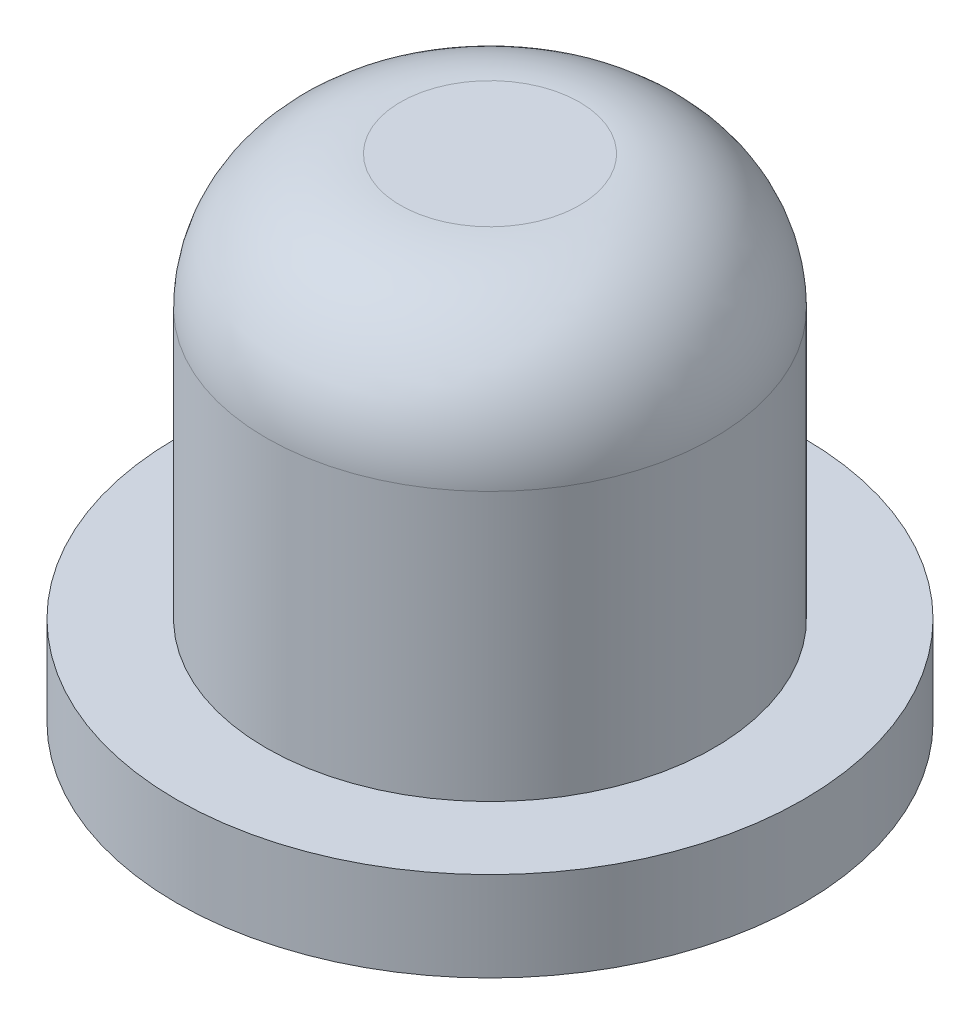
SolidWorks part; units mm, degrees
ref_plane "Front Plane" through (0, 0, 0) normal (0, 0, 1) x (1, 0, 0)
ref_plane "Top Plane" through (0, 0, 0) normal (0, 1, 0) x (1, 0, 0)
ref_plane "Right Plane" through (0, 0, 0) normal (1, 0, 0) x (0, 0, -1)
sketch "Sketch1" plane through (0, 0, 0) normal (0, 0, 1) x (1, 0, 0)
  line L0 (0, 0) -> (0, 6.3556) construction
  line L1 (0, 0) -> (-2.5, 0)
  line L2 (-2.5, 0) -> (-2.5, -0.5)
  line L3 (-2.5, -0.5) -> (-3.5, -0.5)
  line L4 (-3.5, -0.5) -> (-3.5, 0.5)
  line L5 (-3.5, 0.5) -> (-2.5, 0.5)
  line L6 (-2.5, 0.5) -> (-2.5, 3.5)
  line L7 (-1, 5) -> (0, 5)
  line L8 (0, 5) -> (0, 0)
  arc A0 (-2.5, 3.5) -> (-1, 5) centre (-1, 3.5) cw
  dimension "D7" = 1.5
  dimension "D1" = 2.5
  dimension "D2" = 5
  dimension "D3" = 1
  dimension "D4" = 1
  dimension "D5" = 1
  dimension "D6" = 0.5
revolve "Revolve1" add sketch "Sketch1" angle 360 about L0
shell "Shell1" thickness 1
